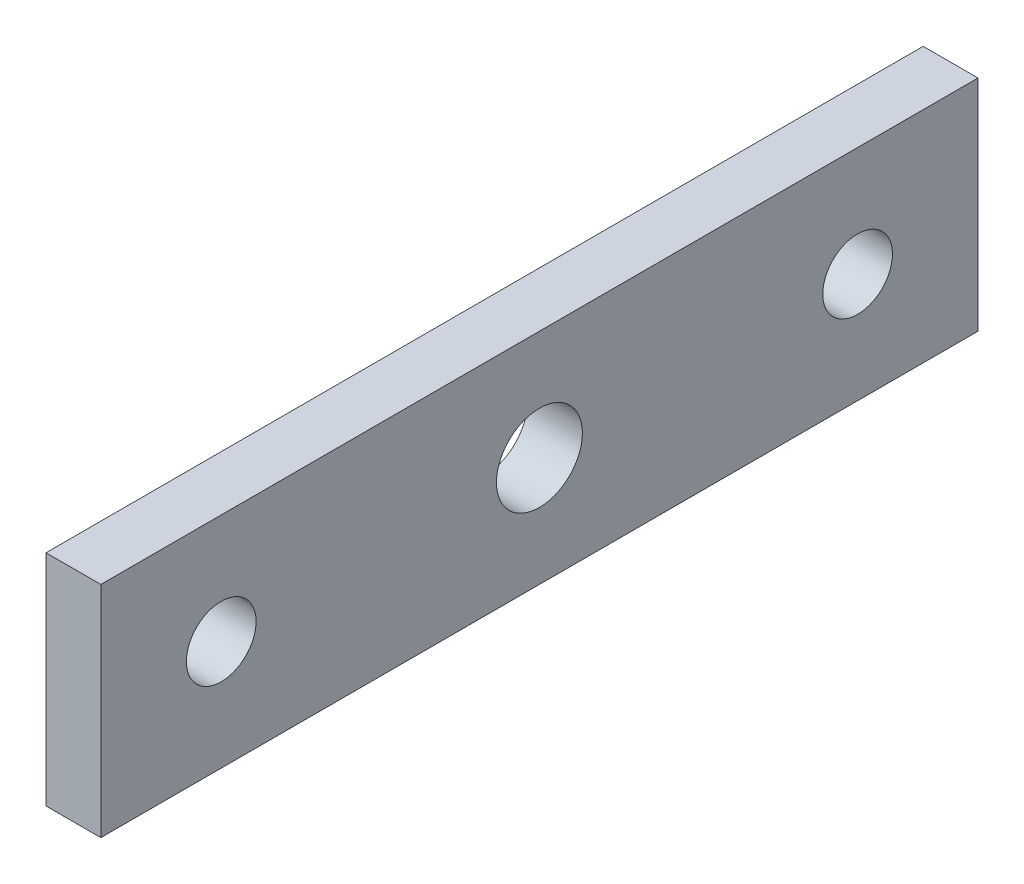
SolidWorks part; units mm, degrees
ref_plane "Front Plane" through (0, 0, 0) normal (0, 0, 1) x (1, 0, 0)
ref_plane "Top Plane" through (0, 0, 0) normal (0, 1, 0) x (1, 0, 0)
ref_plane "Right Plane" through (0, 0, 0) normal (1, 0, 0) x (0, 0, -1)
sketch "Sketch1" plane through (0, 0, 0) normal (1, 0, 0) x (0, 0, -1)
  line L0 (6.9723, -6.35) -> (43.8277, -6.35) construction
  line L1 (0, 0) -> (50.8, 0)
  line L2 (0, 0) -> (0, -12.7)
  line L3 (0, -12.7) -> (50.8, -12.7)
  line L4 (50.8, 0) -> (50.8, -12.7)
  line L5 (0, 0) -> (50.8, -12.7) construction
  circle A0 centre (6.9723, -6.35) radius 2.0193
  circle A1 centre (43.8277, -6.35) radius 2.0193
  circle A2 centre (25.4, -6.35) radius 2.4892
  point P9 (25.4, -6.35)
  dimension "D4" = 4.0386
  dimension "D5" = 4.9784
  dimension "D1" = 50.8
  dimension "D2" = 12.7
  dimension "D3" = 36.8554
extrude "Boss-Extrude1" add sketch "Sketch1" along normal blind 3.175
